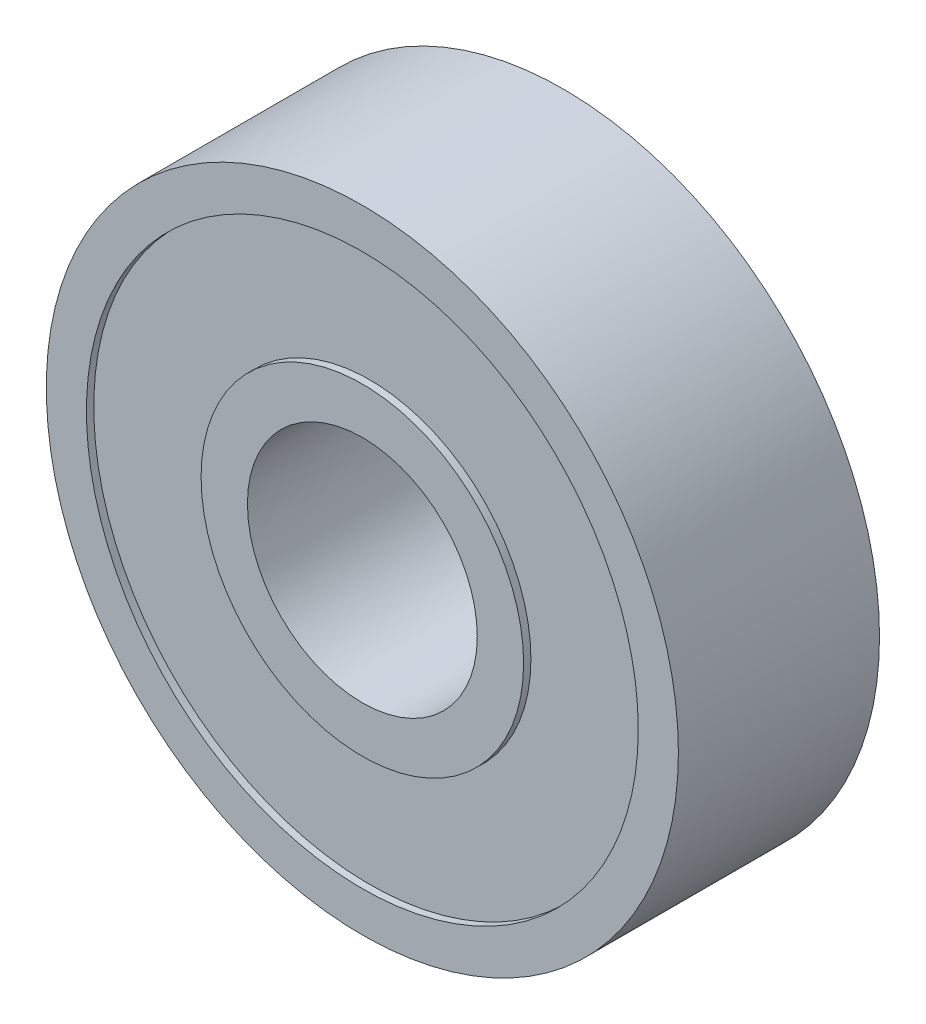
SolidWorks part; units mm, degrees
ref_plane "Front Plane" through (0, 0, 0) normal (0, 0, 1) x (1, 0, 0)
ref_plane "Top Plane" through (0, 0, 0) normal (0, 1, 0) x (1, 0, 0)
ref_plane "Right Plane" through (0, 0, 0) normal (1, 0, 0) x (0, 0, -1)
sketch "Sketch1" plane through (0, 0, 0) normal (0, 0, 1) x (1, 0, 0)
  circle A0 centre (0, 0) radius 11
  circle A2 centre (0, 0) radius 9.603
  circle A3 centre (0, 0) radius 4
  circle A4 centre (0, 0) radius 5.6129
  dimension "D1" = 22
  dimension "D2" = 1.397
  dimension "D3" = 8
  dimension "D4" = 1.6129
extrude "Boss-Extrude1" add sketch "Sketch1" along normal blind 7 contours A0 A2 | A4 A3
sketch "Sketch3" plane through (0, 0, 7) normal (0, 0, 1) x (1, 0, 0)
  circle A0 centre (0, 0) radius 5.6129 construction
  circle A1 centre (0, 0) radius 9.603 construction
  circle A2 centre (0, 0) radius 5.6129
  circle A3 centre (0, 0) radius 9.603
extrude "Boss-Extrude2" add sketch "Sketch3" against normal blind 6.492 from offset 0.254
